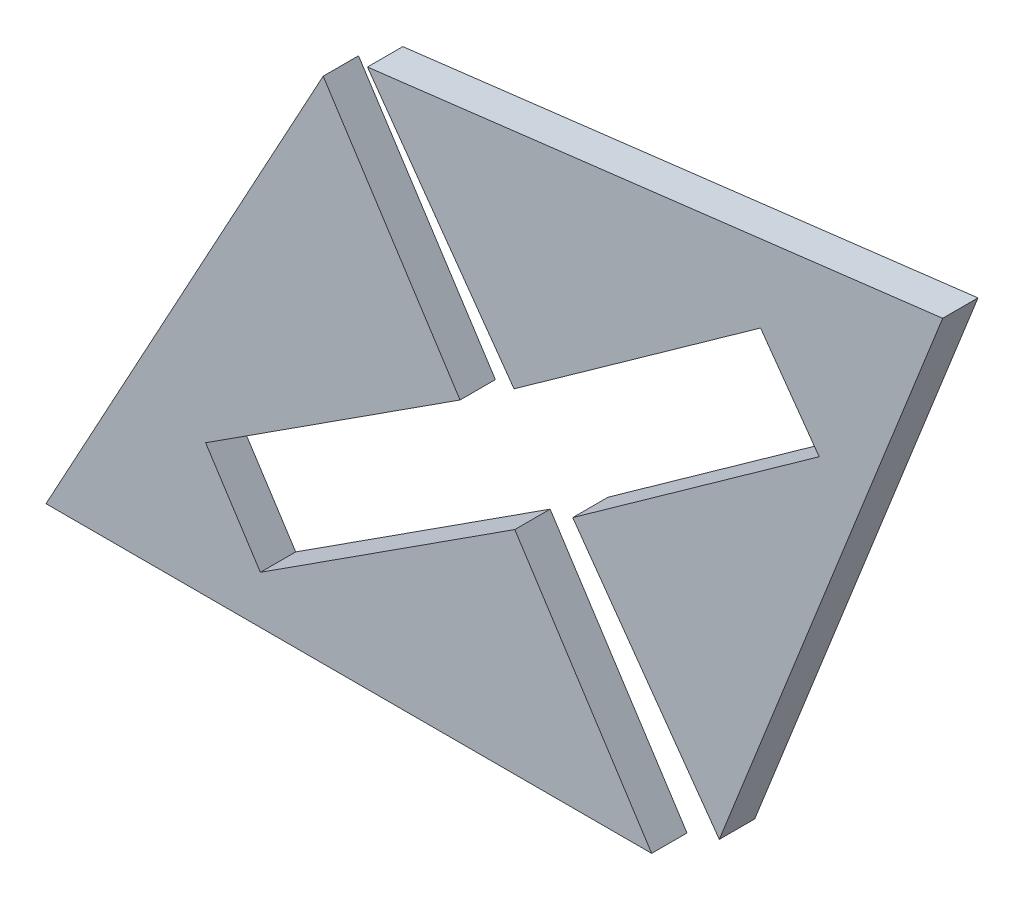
SolidWorks part; units mm, degrees
ref_plane "Front Plane" through (0, 0, 0) normal (0, 0, 1) x (1, 0, 0)
ref_plane "Top Plane" through (0, 0, 0) normal (0, 1, 0) x (1, 0, 0)
ref_plane "Right Plane" through (0, 0, 0) normal (1, 0, 0) x (0, 0, -1)
sketch "Sketch1" plane through (0, 0, 0) normal (0, 0, 1) x (1, 0, 0)
  line L0 (-21.7209, 41.3926) -> (-49.1793, -9.0162)
  line L1 (-49.1793, -9.0162) -> (10.8207, -9.0162)
  line L2 (10.8207, -9.0162) -> (-2.7383, 11.9875)
  line L3 (-8.1619, 20.3889) -> (-33.3663, 4.1182)
  line L4 (-33.3663, 4.1182) -> (-27.9427, -4.2833)
  line L5 (-27.9427, -4.2833) -> (-2.7383, 11.9875)
  line L6 (-8.1619, 20.3889) -> (-21.7209, 41.3926)
  line L7 (-21.2065, 45.3547) -> (25.634, -23.6207) construction
  line L8 (-2.8108, 24.0228) -> (-17.3339, 44.3717)
  line L9 (27.4171, 33.311) -> (2.9984, 15.8832)
  line L10 (21.6079, 41.4505) -> (27.4171, 33.311)
  line L11 (-2.8108, 24.0228) -> (21.6079, 41.4505)
  line L12 (17.5215, -4.4657) -> (2.9984, 15.8832)
  line L13 (39.648, 51.3054) -> (17.5215, -4.4657)
  line L14 (-17.3339, 44.3717) -> (39.648, 51.3054)
  dimension "D1" = 60
  dimension "D2" = 60
  dimension "D3" = 25
  dimension "D4" = 25
  dimension "D5" = 30
  dimension "D6" = 10
extrude "Boss-Extrude1" add sketch "Sketch1" along normal blind 3.5
